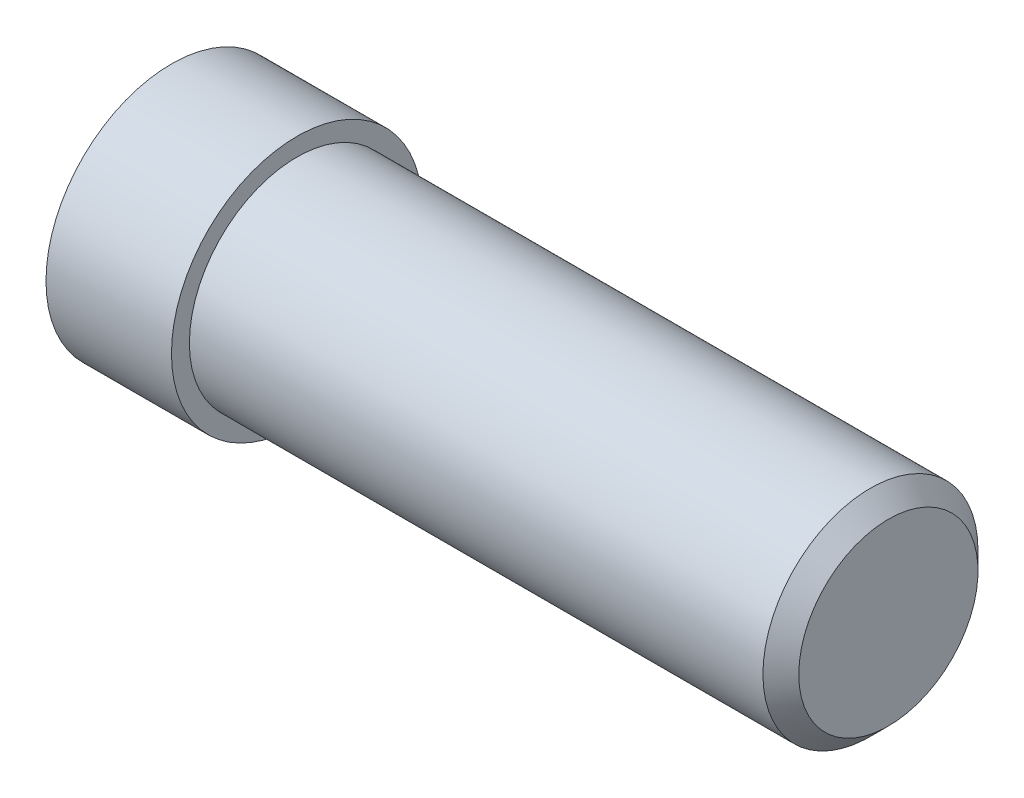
SolidWorks part; units mm, degrees
ref_plane "Front Plane" through (0, 0, 0) normal (0, 0, 1) x (1, 0, 0)
ref_plane "Top Plane" through (0, 0, 0) normal (0, 1, 0) x (1, 0, 0)
ref_plane "Right Plane" through (0, 0, 0) normal (1, 0, 0) x (0, 0, -1)
sketch "Sketch1" plane through (0, 0, 0) normal (0, 0, 1) x (1, 0, 0)
  line L0 (-48.8814, 20.1102) -> (32.6271, 20.1102) construction
  line L2 (-41.0508, 26.1102) -> (-8.0508, 26.1102)
  line L4 (-41.0508, 20.1102) -> (-8.0508, 20.1102)
  line L5 (-8.0508, 26.1102) -> (-8.0508, 20.1102)
  line L6 (-48.0508, 27.1102) -> (-41.0508, 27.1102)
  line L7 (-48.0508, 27.1102) -> (-48.0508, 20.1102)
  line L8 (-48.0508, 20.1102) -> (-41.0508, 20.1102)
  line L9 (-41.0508, 27.1102) -> (-41.0508, 26.1102)
  dimension "D1" = 7
  dimension "D2" = 7
  dimension "D3" = 33
  dimension "D4" = 6
revolve "Revolve1" add sketch "Sketch1" angle 360 about L0
chamfer "Chamfer1" distance 1 angle 45 1 edges at (-8.0508, 20.1102, 6)
scale "Scale1" scale about centroid uniform scaling yes scale factor 0.75
